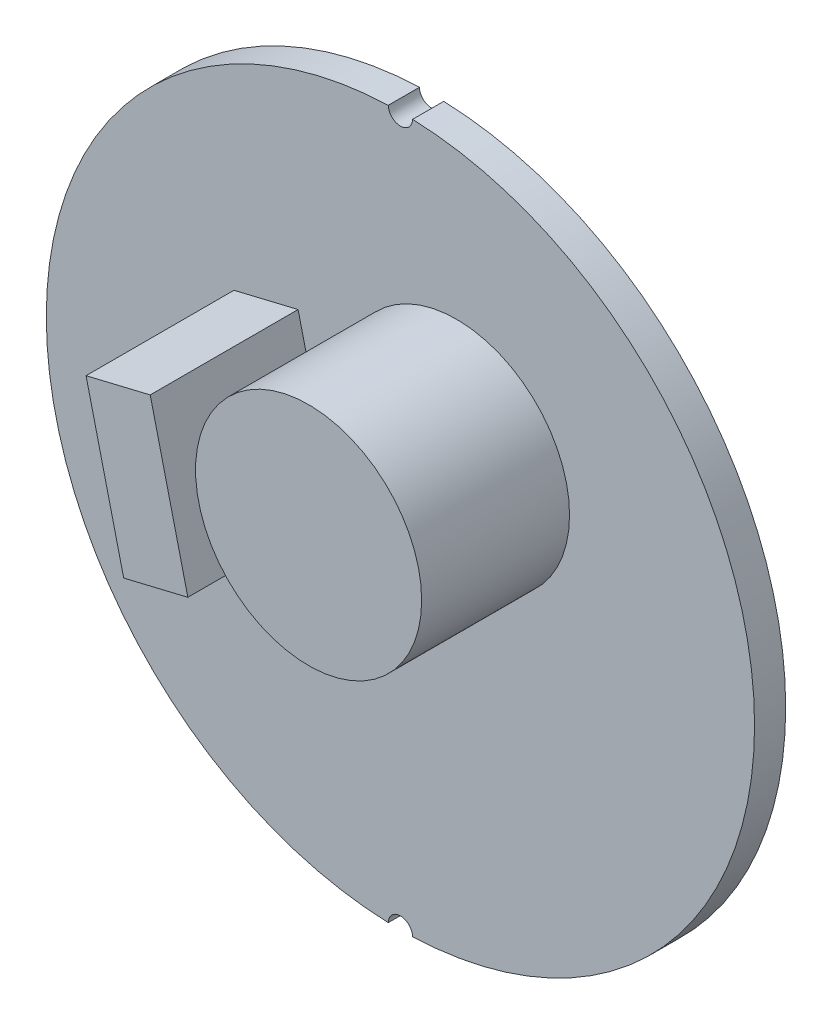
SolidWorks part; units mm, degrees
ref_plane "Front" through (0, 0, 0) normal (0, 0, 1) x (1, 0, 0)
ref_plane "Top" through (0, 0, 0) normal (0, 1, 0) x (1, 0, 0)
ref_plane "Right" through (0, 0, 0) normal (1, 0, 0) x (0, 0, -1)
sketch "Sketch1" plane through (0, 0, 0) normal (0, 0, 1) x (1, 0, 0)
  circle A0 centre (0, 0) radius 23.114
  dimension "D1" = 46.228
extrude "Boss-Extrude1" add sketch "Sketch1" along normal blind 2.032
sketch "Sketch2" plane through (0, 0, 2.032) normal (0, 0, 1) x (1, 0, 0)
  line L0 (-10.8665, 7.6066) -> (-6.6789, 8.6137)
  line L1 (-10.8665, 7.6066) -> (-8.4106, -2.6049)
  line L2 (-6.6789, 8.6137) -> (-4.223, -1.5977)
  line L3 (-8.4106, -2.6049) -> (-4.223, -1.5977)
  circle A0 centre (3.6575, 5.8573) radius 7.3795
extrude "Boss-Extrude3" add sketch "Sketch2" along normal blind 9.652
sketch "Sketch3" plane through (0, 0, 2.032) normal (0, 0, 1) x (1, 0, 0)
  circle A0 centre (0, 23.114) radius 0.7937
  circle A1 centre (0, 0) radius 23.114 construction
  circle A2 centre (0, -23.114) radius 0.7937
  dimension "D1" = 1.5875
extrude "Cut-Extrude1" cut sketch "Sketch3" against normal blind 9.652
